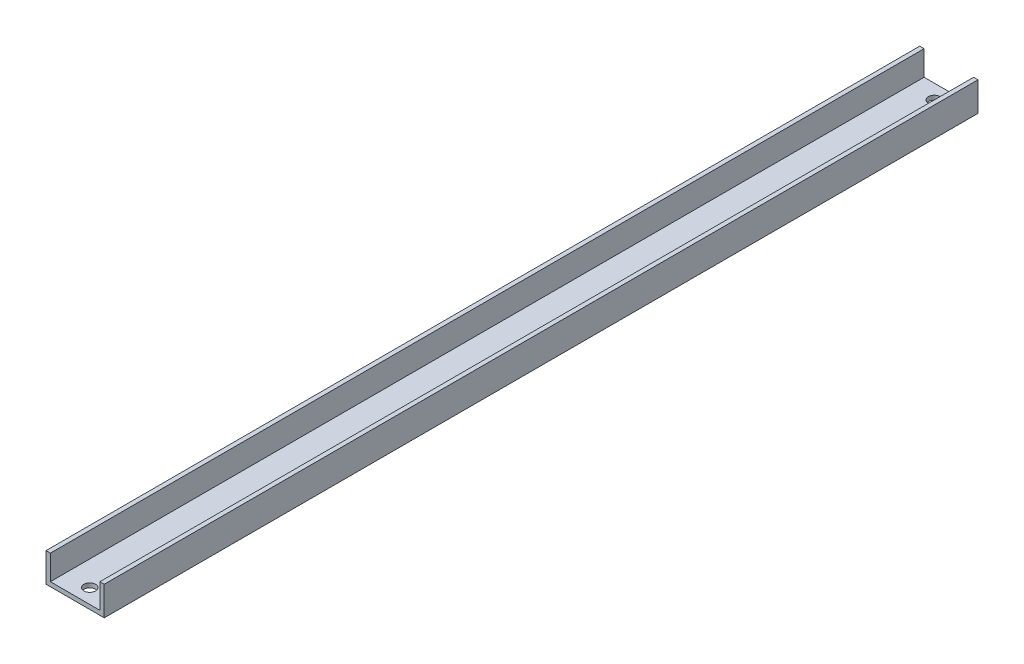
SolidWorks part; units mm, degrees
ref_plane "Plan de face" through (0, 0, 0) normal (0, 0, 1) x (1, 0, 0)
ref_plane "Plan de dessus" through (0, 0, 0) normal (0, 1, 0) x (1, 0, 0)
ref_plane "Plan de droite" through (0, 0, 0) normal (1, 0, 0) x (0, 0, -1)
sketch "Esquisse1" plane through (0, 0, 0) normal (0, 0, 1) x (1, 0, 0)
  line L0 (0, 43.3365) -> (0, -28.9354) construction
  line L1 (10, 0) -> (-10, 0)
  line L2 (-10, 0) -> (-10, 10)
  line L3 (-8.5, 1.5) -> (-8.5, 10)
  line L4 (8.5, 1.5) -> (-8.5, 1.5)
  line L5 (-10, 10) -> (-8.5, 10)
  line L6 (10, 10) -> (8.5, 10)
  line L7 (8.5, 1.5) -> (8.5, 10)
  line L8 (10, 0) -> (10, 10)
  point P12 (0, 1.5)
  point P13 (0, 0)
  dimension "D1" = 10
  dimension "D2" = 10
  dimension "D3" = 1.5
extrude "Extrusion1" add sketch "Esquisse1" along normal blind 300
sketch "Esquisse2" plane through (0, 0, 0) normal (0, -1, 0) x (1, 0, 0)
  line L0 (-10, 0) -> (10, 0) construction
  circle A0 centre (0, 5) radius 2
  circle A1 centre (0, 295) radius 2
  dimension "D2" = 4
  dimension "D1" = 5
  dimension "D3" = 290
extrude "Enlèv. mat.-Extru.1" cut sketch "Esquisse2" against normal through all
